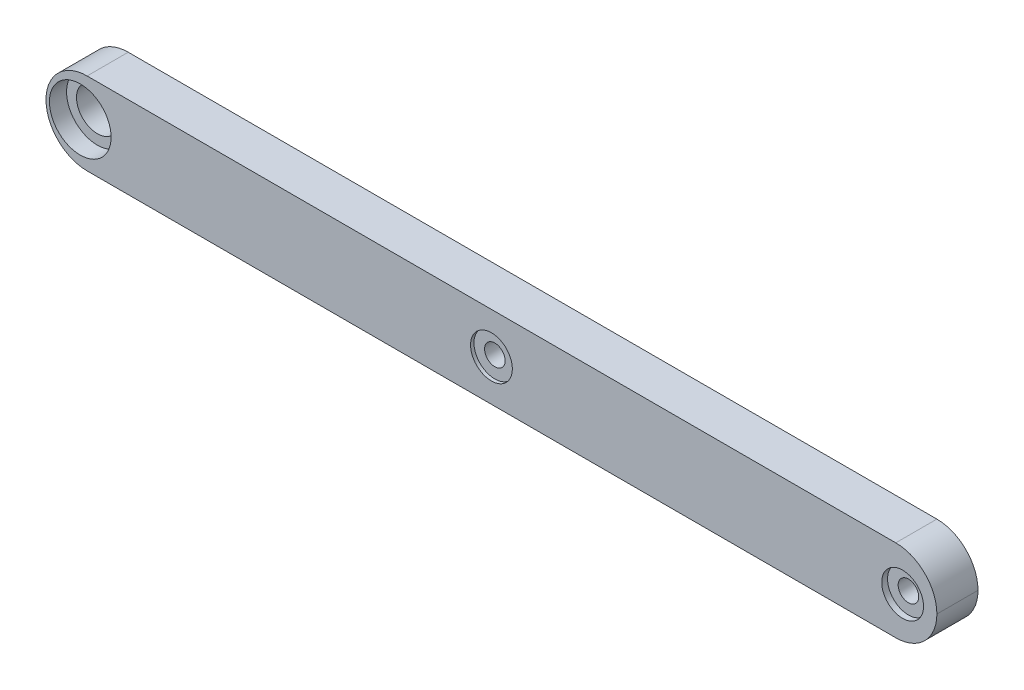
SolidWorks part; units mm, degrees
ref_plane "Face" through (0, 0, 0) normal (0, 0, 1) x (1, 0, 0)
ref_plane "Dessus" through (0, 0, 0) normal (0, 1, 0) x (1, 0, 0)
ref_plane "Droite" through (0, 0, 0) normal (1, 0, 0) x (0, 0, -1)
sketch "Esquisse1" plane through (0, 0, 0) normal (0, 0, 1) x (1, 0, 0)
  line L1 (-69.639, 12.2396) -> (60.361, 12.2396)
  line L2 (-69.639, 12.2396) -> (-69.639, 0.2396)
  line L3 (-69.639, 0.2396) -> (60.361, 0.2396)
  line L4 (60.361, 12.2396) -> (60.361, 0.2396)
  dimension "D1" = 130
  dimension "D2" = 12
extrude "Base-Extrusion" add sketch "Esquisse1" along normal blind 6
sketch "Esquisse2" plane through (0, 0, 6) normal (0, 0, 1) x (1, 0, 0)
  line L0 (60.361, 12.2396) -> (-69.639, 12.2396) construction
  line L2 (60.361, 0.2396) -> (60.361, 12.2396) construction
  line L4 (-69.639, 12.2396) -> (-69.639, 0.2396) construction
  circle A0 centre (55.361, 6.2396) radius 1.5
  circle A1 centre (-64.639, 6.2396) radius 3.05
  circle A2 centre (-4.639, 6.2396) radius 1.5
  dimension "D1" = 3
  dimension "D4" = 6
  dimension "D6" = 6
  dimension "D8" = 3
  dimension "D9" = 6.1
  dimension "D2" = 6
  dimension "D3" = 5
  dimension "D5" = 60
  dimension "D7" = 60
  dimension "D10" = 5
extrude "Enlèv. mat.-Extru.1" cut sketch "Esquisse2" against normal up to vertex
fillet "Congé1" radius 6 8 edges at (60.361, 6.2396, 6) (-69.639, 6.2396, 6) (60.361, 6.2396, 0) (-69.639, 6.2396, 0) (-69.639, 12.2396, 3) (60.361, 12.2396, 3) (60.361, 0.2396, 3) (-69.639, 0.2396, 3)
sketch "Esquisse3" plane through (0, 0, 6) normal (0, 0, 1) x (1, 0, 0)
  line L1 (-63.639, 0.2396) -> (54.361, 0.2396) construction
  circle A0 centre (-4.639, 6.2396) radius 3.05
  dimension "D1" = 6.1
  dimension "D3" = 65
  dimension "D2" = 6
extrude "Enlèv. mat.-Extru.2" cut sketch "Esquisse3" against normal blind 0.5
sketch "Esquisse4" plane through (0, 0, 6) normal (0, 0, 1) x (1, 0, 0)
  line L0 (54.361, 12.2396) -> (-63.639, 12.2396) construction
  circle A0 centre (-64.639, 6.2396) radius 4.5
  dimension "D1" = 6
  dimension "D2" = 5
extrude "Enlèv. mat.-Extru.3" cut sketch "Esquisse4" against normal blind 2.5
sketch "Esquisse5" plane through (0, 0, 6) normal (0, 0, 1) x (1, 0, 0)
  line L0 (-63.639, 0.2396) -> (54.361, 0.2396) construction
  circle A0 centre (55.361, 6.2396) radius 3.05
  dimension "D1" = 6
  dimension "D2" = 5
extrude "Enlèv. mat.-Extru.4" cut sketch "Esquisse5" against normal blind 0.85
